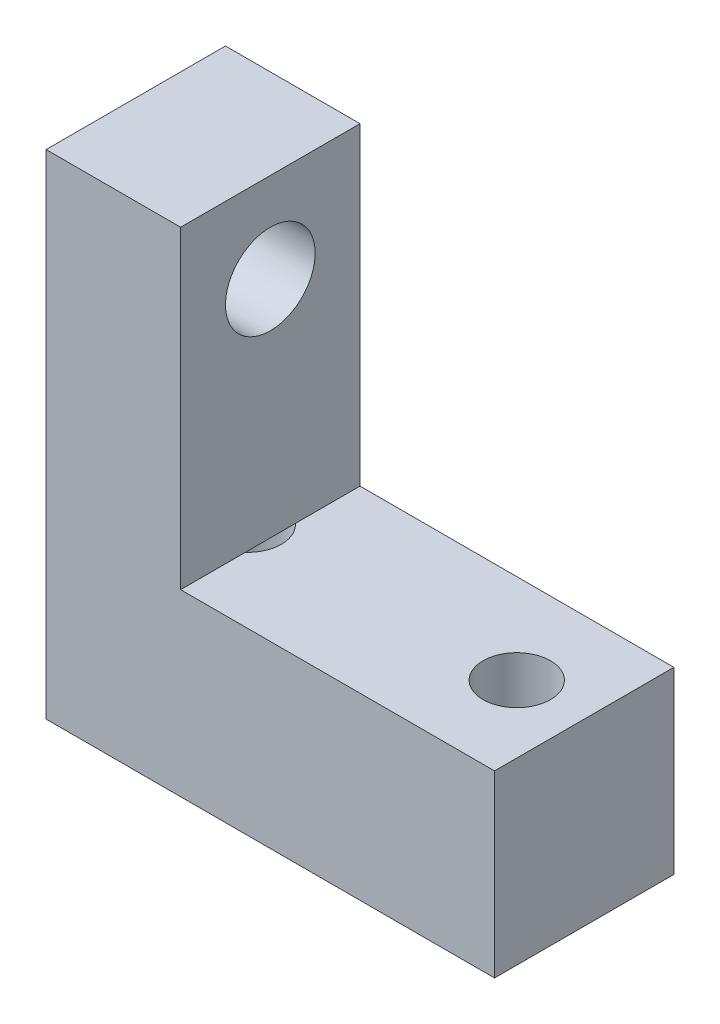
SolidWorks part; units mm, degrees
ref_plane "Front Plane" through (0, 0, 0) normal (0, 0, 1) x (1, 0, 0)
ref_plane "Top Plane" through (0, 0, 0) normal (0, 1, 0) x (1, 0, 0)
ref_plane "Right Plane" through (0, 0, 0) normal (1, 0, 0) x (0, 0, -1)
sketch "Sketch4" plane through (0, 0, 0) normal (0, 0, 1) x (1, 0, 0)
  line L0 (0, 0) -> (31.75, 0)
  line L1 (31.75, 0) -> (31.75, 12.7)
  line L2 (31.75, 12.7) -> (9.525, 12.7)
  line L3 (9.525, 12.7) -> (9.525, 34.925)
  line L4 (9.525, 34.925) -> (0, 34.925)
  line L5 (0, 34.925) -> (0, 0)
  line L6 (0, 28.575) -> (9.525, 28.575) construction
  line L7 (26.9748, 0) -> (26.9748, 9.8399) construction
  line L8 (7.9248, 0) -> (7.9248, 9.8399) construction
  dimension "D1" = 34.925
  dimension "D2" = 12.7
  dimension "D3" = 9.525
  dimension "D4" = 31.75
  dimension "D5" = 7.9248
  dimension "D6" = 19.05
  dimension "D7" = 28.575
sketch "Sketch5" plane through (0, 0, 0) normal (0, 0, 1) x (1, 0, 0)
  line L0 (0, 0) -> (31.75, 0) construction
  line L1 (31.75, 0) -> (31.75, 12.7) construction
  line L2 (31.75, 12.7) -> (9.525, 12.7) construction
  line L3 (9.525, 12.7) -> (9.525, 34.925) construction
  line L4 (9.525, 34.925) -> (0, 34.925) construction
  line L5 (0, 34.925) -> (0, 0) construction
  line L6 (0, 0) -> (31.75, 0)
  line L7 (31.75, 0) -> (31.75, 12.7)
  line L8 (31.75, 12.7) -> (9.525, 12.7)
  line L9 (9.525, 12.7) -> (9.525, 34.925)
  line L10 (9.525, 34.925) -> (0, 34.925)
  line L11 (0, 34.925) -> (0, 0)
extrude "Boss-Extrude1" add sketch "Sketch5" along normal mid plane 12.7
sketch "Sketch6" plane through (0, 0, 0) normal (0, 1, 0) x (1, 0, 0)
  circle A0 centre (7.9248, 0) radius 2.3876
  circle A1 centre (26.9748, 0) radius 2.3876
  dimension "D1" = 4.7752
extrude "Cut-Extrude1" cut sketch "Sketch6" along normal blind 12.7
sketch "Sketch7" plane through (0, 0, 0) normal (1, 0, 0) x (0, 0, -1)
  circle A0 centre (0, 28.575) radius 3.175
  dimension "D1" = 6.35
extrude "Cut-Extrude2" cut sketch "Sketch7" along normal blind 17.78
